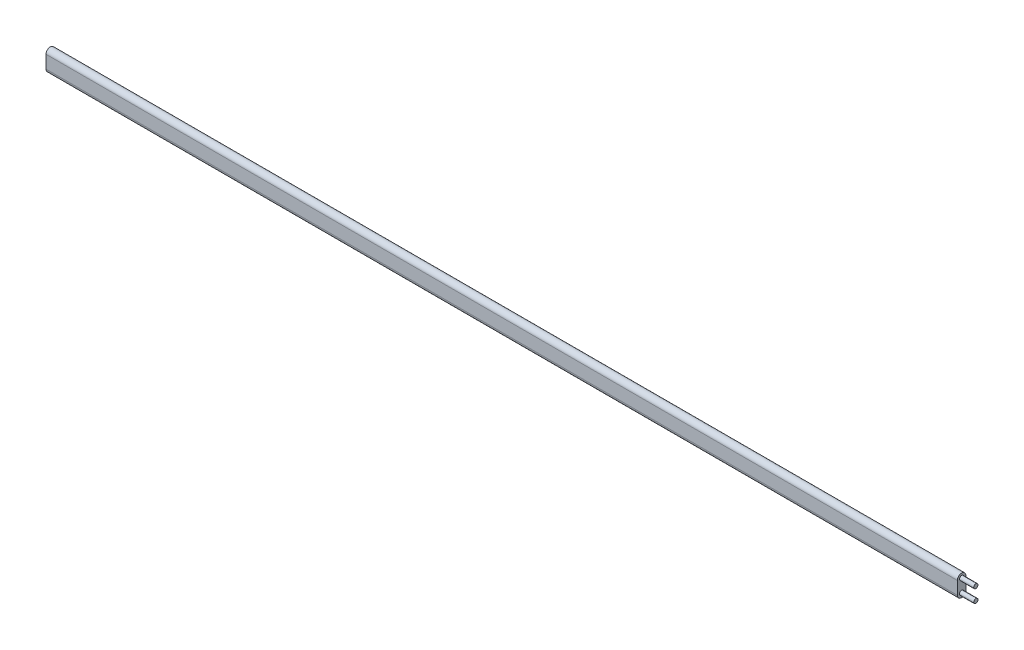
SolidWorks part; units mm, degrees
ref_plane "Plan de face" through (0, 0, 0) normal (0, 0, 1) x (1, 0, 0)
ref_plane "Plan de dessus" through (0, 0, 0) normal (0, 1, 0) x (1, 0, 0)
ref_plane "Plan de droite" through (0, 0, 0) normal (1, 0, 0) x (0, 0, -1)
sketch "Esquisse1" plane through (0, 0, 0) normal (1, 0, 0) x (0, 0, -1)
  line L0 (-3, -4.5) -> (-3, 4.5)
  line L1 (3, 4.5) -> (3, -4.5)
  arc A0 (-3, 4.5) -> (3, 4.5) centre (0, 4.5) cw
  arc A1 (3, -4.5) -> (-3, -4.5) centre (0, -4.5) cw
  point P6 (-3, 0)
  dimension "D1" = 15
  dimension "D2" = 6
extrude "Extrusion1" add sketch "Esquisse1" against normal blind 640
sketch "Esquisse2" plane through (0, 0, 0) normal (1, 0, 0) x (0, 0, -1)
  circle A0 centre (0, 4.5) radius 1.5
  circle A1 centre (0, -4.5) radius 1.5
  dimension "D1" = 3
  dimension "D2" = 3
extrude "Extrusion2" add sketch "Esquisse2" along normal blind 10
